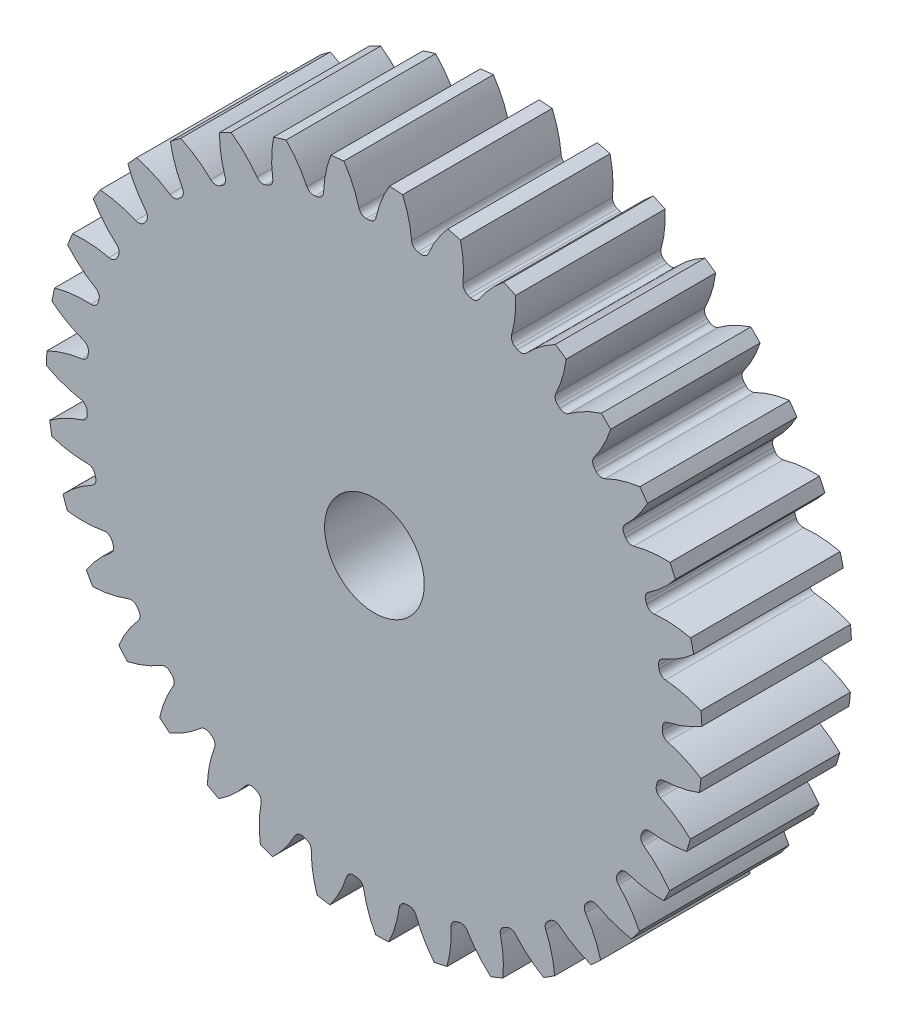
SolidWorks part; units mm, degrees
ref_plane "Front" through (0, 0, 0) normal (0, 0, 1) x (1, 0, 0)
ref_plane "Top" through (0, 0, 0) normal (0, 1, 0) x (1, 0, 0)
ref_plane "Right" through (0, 0, 0) normal (1, 0, 0) x (0, 0, -1)
sketch "Sketch3" plane through (0, 0, 0) normal (0, 0, 1) x (1, 0, 0)
  circle A0 centre (0, 0) radius 208.8444
  dimension "od" = 417.6889
extrude "gearBody" add sketch "Sketch3" along normal blind 95.25
sketch "Sketch2" plane through (0, 0, 0) normal (0, 0, 1) x (1, 0, 0)
  line L0 (0, 0) -> (171.5104, 71.0419) construction
  line L1 (208.2172, -19.1603) -> (0, 0) construction
  line L2 (0, 0) -> (36.3143, 0) construction
  line L3 (197.5014, 4.6252) -> (197.1251, -13.0345) construction
  line L5 (197.3132, -4.2047) -> (0, 0) construction
  line L7 (0, 0) -> (185.6415, 0) construction
  arc A0 (185.638, 1.1339) -> (185.4212, -9.0411) centre (0, 0) ccw construction
  arc A1 (208.599, 10.1227) -> (207.9784, -18.9998) centre (0, 0) ccw construction
  arc A2 (197.5014, 4.6252) -> (197.1251, -13.0345) centre (0, 0) ccw construction
  arc A3 (183.3808, -4.8329) -> (183.4202, -2.9835) centre (0, 0) ccw
  arc A4 (208.2172, -19.1603) -> (186.7848, -9.392) centre (168.3283, -78.2838) ccw
  arc A5 (208.2172, -19.1603) -> (208.8444, 10.2728) centre (0, 0) ccw
  arc A6 (208.8444, 10.2728) -> (187.0153, 1.4264) centre (171.5104, 71.0419) cw
  arc A7 (183.4202, -2.9835) -> (187.0153, 1.4264) centre (188.0142, -3.0583) cw
  arc A8 (186.7848, -9.392) -> (183.3808, -4.8329) centre (187.9738, -4.9539) cw
  point P6 (208.8444, 10.2728)
  point P22 (208.2172, -19.1603)
  dimension "baseDia" = 371.283
  dimension "od" = 417.6889
  dimension "pd" = 395.1111
  dimension "rd" = 366.8889
  dimension "rFillet" = 4.5946
  dimension "pointX" = 208.8444
  dimension "pointY" = 10.2728
  dimension "CTT" = 17.6597
  dimension "flankCenterAngle" = 22.5
extrude "toothCut" cut sketch "Sketch2" along normal through all
pattern_circular "CirPattern1" count 35 over 360 about axis through (0, 0, 0) along (0, 0, 1) of "toothCut"
sketch "hub1Dia" plane through (0, 0, 0) normal (0, 0, -1) x (-1, 0, 0)
  circle A0 centre (0, 0) radius 12.7
  dimension "hub1Dia" = 25.4
sketch "hub2Dia" plane through (0, 0, 95.25) normal (0, 0, 1) x (1, 0, 0)
  circle A0 centre (0, 0) radius 12.7
  dimension "hub2dia" = 25.4
sketch "boreDia" plane through (0, 0, 0) normal (0, 0, 1) x (1, 0, 0)
  circle A0 centre (0, 0) radius 31.75
  dimension "boreDia" = 63.5
extrude "bore" cut sketch "boreDia" against normal mid plane 25400
